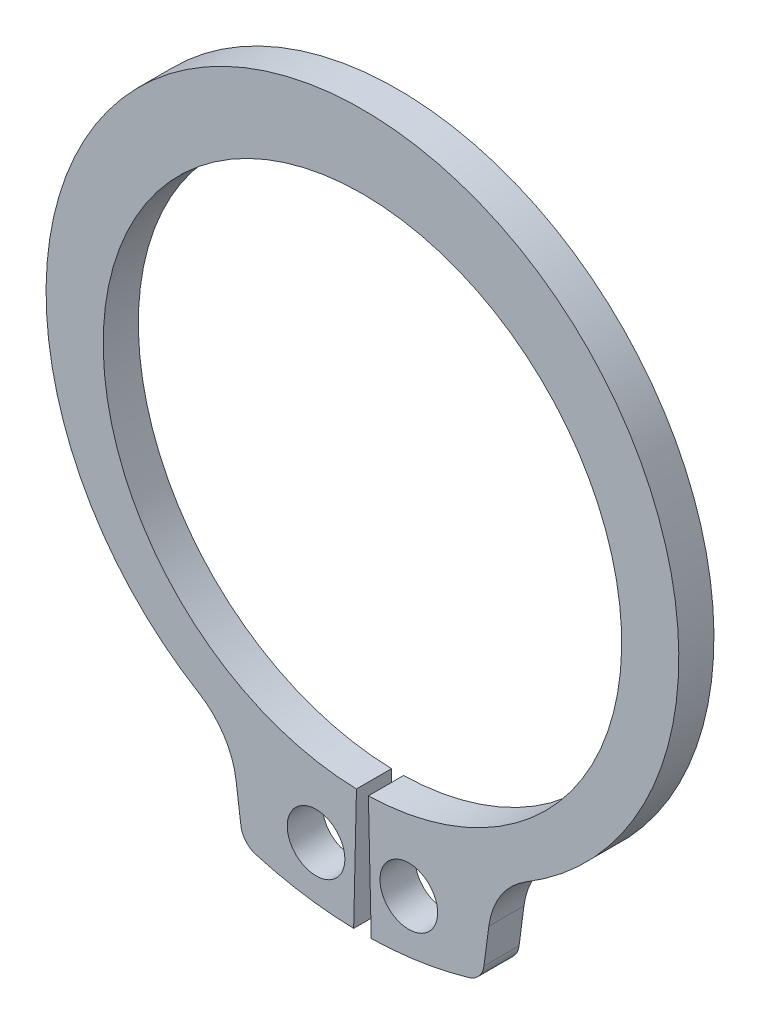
SolidWorks part; units mm, degrees
ref_plane "Plane1" through (0, 0, 0) normal (0, 0, 1) x (1, 0, 0)
ref_plane "Plane2" through (0, 0, 0) normal (0, 1, 0) x (1, 0, 0)
ref_plane "Plane3" through (0, 0, 0) normal (1, 0, 0) x (0, 0, -1)
extrude "Body" add sketch "BodySke" against normal blind 0.635
sketch "BodySke" plane through (0, 0, 0) normal (0, 0, 1) x (1, 0, 0)
  line L0 (-1.5431, 0) -> (1.5431, 0) construction
  line L1 (0, 0) -> (0, 6.0071) construction
  line L2 (0.1079, -4.6851) -> (0.1588, -6.8943)
  line L3 (-0.1079, -4.6851) -> (-0.1588, -6.8943)
  line L4 (0, 0) -> (3.6945, -5.823) construction
  line L5 (0, 0) -> (-3.6945, -5.823) construction
  line L7 (2.2847, -5.6374) -> (2.1967, -6.3058)
  line L8 (-2.2847, -5.6374) -> (-2.1967, -6.3058)
  circle A0 centre (0, 0) radius 4.6863 construction
  arc A1 (0.1079, -4.6851) -> (-0.1079, -4.6851) centre (0, 0) ccw
  arc A2 (2.9325, -4.6219) -> (-2.9325, -4.6219) centre (0, 0.2881) ccw construction
  arc A3 (0.1588, -6.8943) -> (1.9253, -6.6219) centre (0, 0) ccw
  arc A4 (2.9588, -4.6061) -> (2.2847, -5.6374) centre (3.6945, -5.823) ccw
  arc A5 (-2.2847, -5.6374) -> (-2.9588, -4.6061) centre (-3.6945, -5.823) ccw
  arc A6 (-1.9253, -6.6219) -> (-0.1588, -6.8943) centre (0, 0) ccw
  arc A7 (2.9588, -4.6061) -> (-2.9588, -4.6061) centre (0, 0.2881) ccw
  arc A8 (-2.3047, -5.4855) -> (2.3047, -5.4855) centre (0, 0) ccw construction
  circle A9 centre (0.8382, -5.8906) radius 0.5207
  circle A10 centre (-0.8382, -5.8906) radius 0.5207
  arc A11 (2.1967, -6.3058) -> (1.9253, -6.6219) centre (1.8189, -6.256) cw
  arc A12 (-2.1967, -6.3058) -> (-1.9253, -6.6219) centre (-1.8189, -6.256) ccw
  point P28 (2.1649, -6.5475)
  point P31 (-2.1649, -6.5475)
  dimension "GrooveDia" = 9.3726
  dimension "D3" = 0.381
  dimension "LugRad" = 6.8961
  dimension "HoleOffsetRad" = 5.95
  dimension "HoleDia" = 1.0414
  dimension "D2" = 15
  dimension "LargeRad" = 6.0071
  dimension "SmallRad" = 5.4737
  dimension "Gap" = 0.3175
  dimension "SmallAngle" = 64.788
  dimension "HoleSpacing" = 1.6764
sketch "Clipboard" plane through (0, 0, 0) normal (0, 0, 1) x (1, 0, 0)
  line L0 (0, 0) -> (1.3208, 0)
  line L1 (0, 0) -> (0, 0.7874)
  line L2 (0, 0) -> (0, -2.2098)
  circle A0 centre (0, 0) radius 0.5207
  circle A1 centre (0, 0) radius 5.0038
  dimension "HoleDia" = 1.0414
  dimension "ShaftDia" = 10.0076
  dimension "LargeSection" = 1.3208
  dimension "SmallSection" = 0.7874
  dimension "LugSection" = 2.2098
sketch "NotSke" plane through (0, 0, 0) normal (0, 0, 1) x (1, 0, 0)
  line L0 (0.8382, -5.3699) -> (0.8382, -6.4113)
  line L1 (0.8382, -6.4113) -> (-0.8382, -6.4113)
  line L2 (-0.8382, -6.4113) -> (-0.8382, -5.3699)
  line L3 (-0.8382, -5.3699) -> (0.8382, -5.3699)
  circle A0 centre (0.8382, -5.8906) radius 0.5207 construction
  circle A1 centre (-0.8382, -5.8906) radius 0.5207 construction
extrude "Notch" [suppressed] cut sketch "NotSke" against normal through all
equation "' \"ShaftDia@Clipboard\" = 0.125"
equation "' \"Thickness@Body\" = 0.01"
equation "' \"GrooveDia@BodySke\" = 0.117"
equation "' \"LugSection@Clipboard\" = 0.046"
equation "' \"LargeSection@Clipboard\" = 0.018"
equation "' \"SmallSection@Clipboard\" = 0.011"
equation "' \"HoleDia@Clipboard\" = 0.026"
equation "' \"ShaftDia@Clipboard\" = 0.394"
equation "' \"Thickness@Body\" = 0.025"
equation "' \"GrooveDia@BodySke\" = 0.369"
equation "' \"LugSection@Clipboard\" = 0.087"
equation "' \"LargeSection@Clipboard\" = 0.052"
equation "' \"SmallSection@Clipboard\" = 0.031"
equation "' \"HoleDia@Clipboard\" = 0.041"
equation "\"Gap@BodySke\" =  \"Thickness@Body\" / 2"
equation "\"LargeRad@BodySke\" =  \"GrooveDia@BodySke\" / 2 +  \"LargeSection@Clipboard\""
equation "\"SmallRad@BodySke\" =  \"GrooveDia@BodySke\" / 2 +  \"SmallSection@Clipboard\""
equation "\"LugRad@BodySke\" = \"GrooveDia@BodySke\" / 2 + \"LugSection@Clipboard\""
equation "\"HoleOffsetRad@BodySke\" = (  \"ShaftDia@Clipboard\" / 2 + \"LugRad@BodySke\" ) / 2"
equation "\"HoleSpacing@BodySke\" = \"Gap@BodySke\"  * 2 +  \"HoleDia@Clipboard\""
equation "\"HoleDia@BodySke\" =  \"HoleDia@Clipboard\""
equation "\"SmallAngle@BodySke\" = atn(\"HoleSpacing@BodySke\" / 2 / sqr(\"HoleOffsetRad@BodySke\"  * \"HoleOffsetRad@BodySke\" - (\"HoleSpacing@BodySke\" / 2) * (\"HoleSpacing@BodySke\" / 2) ))  * 8 * ( 180 / 3.141593)"
